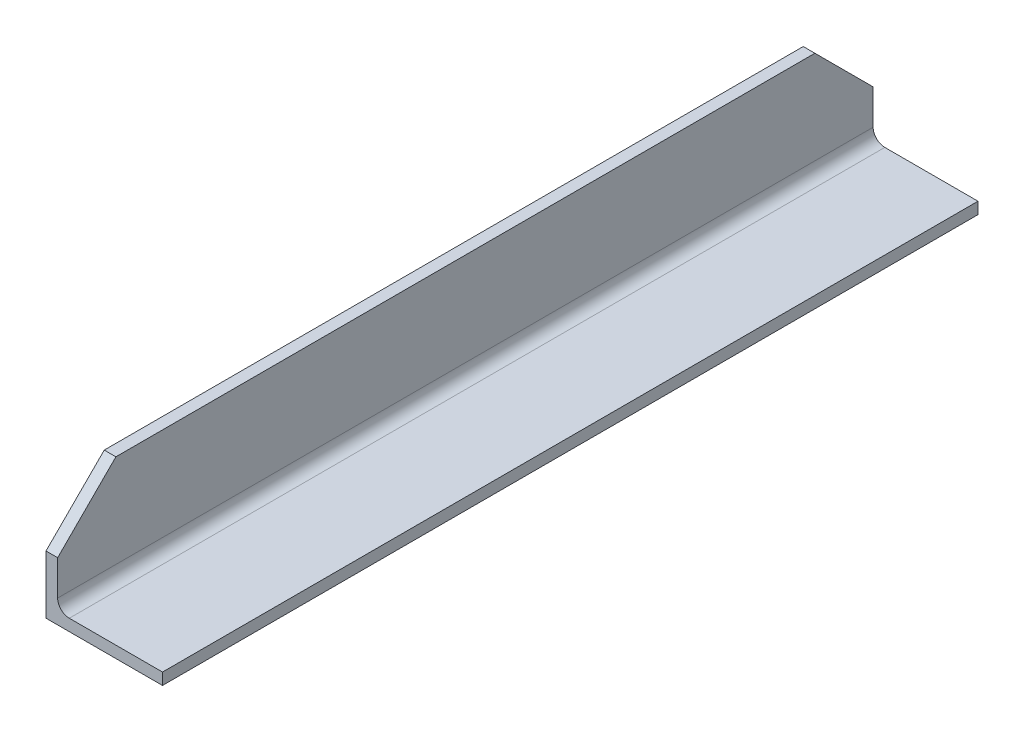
SolidWorks part; units mm, degrees
ref_plane "Front Plane" through (0, 0, 0) normal (0, 0, 1) x (1, 0, 0)
ref_plane "Top Plane" through (0, 0, 0) normal (0, 1, 0) x (1, 0, 0)
ref_plane "Right Plane" through (0, 0, 0) normal (1, 0, 0) x (0, 0, -1)
sketch "Sketch1" plane through (0, 0, 0) normal (0, 0, 1) x (1, 0, 0)
  line L0 (0, 100) -> (0, 0)
  line L1 (0, 0) -> (100, 0)
  line L2 (100, 0) -> (100, 10)
  line L3 (100, 10) -> (20, 10)
  line L4 (10, 20) -> (10, 100)
  line L5 (10, 100) -> (0, 100)
  arc A0 (20, 10) -> (10, 20) centre (20, 20) cw
  dimension "D3" = 10
  dimension "D1" = 100
  dimension "D2" = 10
extrude "Boss-Extrude1" add sketch "Sketch1" along normal blind 700
chamfer "Chamfer1" distance 50 angle 45 2 edges at (5, 100, 0) (5, 100, 700)
